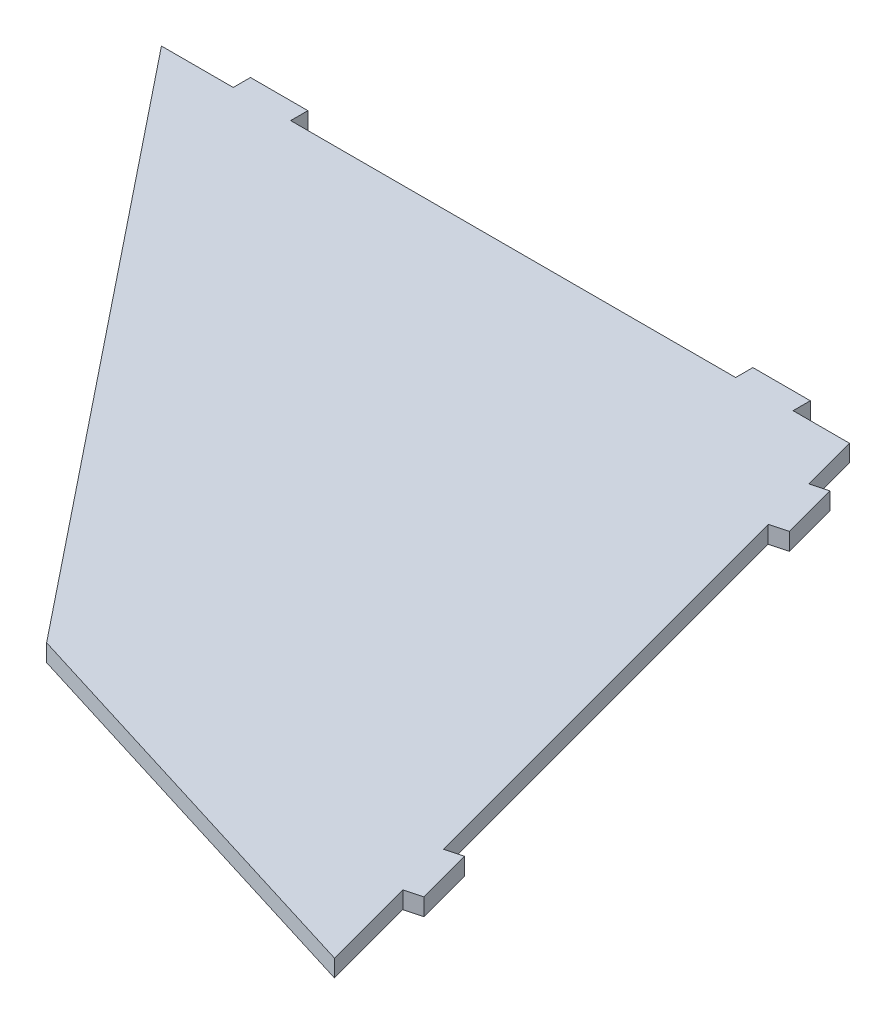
SolidWorks part; units mm, degrees
ref_plane "Ebene vorne" through (0, 0, 0) normal (0, 0, 1) x (1, 0, 0)
ref_plane "Ebene oben" through (0, 0, 0) normal (0, 1, 0) x (1, 0, 0)
ref_plane "Ebene rechts" through (0, 0, 0) normal (1, 0, 0) x (0, 0, -1)
sketch "Skizze1" plane through (0, 0, 0) normal (0, 1, 0) x (1, 0, 0)
  line L0 (0, 86.8409) -> (0, -76.1078) construction
  line L1 (-105.0548, 0) -> (-135, 0) construction
  line L2 (0, -200) -> (0, 86.8409) construction
  line L3 (-224, 0) -> (-135, 0) construction
  line L4 (90.5872, -17.7656) -> (95.7636, -37.0841)
  line L5 (60, 0) -> (60, 6)
  line L6 (160, 0) -> (160, -246.2068) construction
  line L7 (60, 6) -> (40, 6)
  line L8 (40, 0) -> (40, 6)
  line L9 (-115, 0) -> (40, 0) construction
  line L10 (60, 0) -> (160, 0) construction
  line L11 (-135, 0) -> (-135, 6)
  line L12 (-135, 6) -> (-115, 6)
  line L13 (-115, 0) -> (-115, 6)
  line L14 (-115, 0) -> (40, 0) construction
  line L15 (-115, 0) -> (40, 0)
  line L16 (60, 0) -> (79.6152, 0)
  line L17 (90.5872, -17.7656) -> (84.7916, -19.3185)
  line L18 (95.7636, -37.0841) -> (89.968, -38.637)
  line L19 (-160, 0) -> (0, -200)
  line L20 (84.7916, -19.3185) -> (79.6152, 0)
  line L21 (137.1746, -191.6323) -> (142.351, -210.9508)
  line L22 (137.1746, -191.6323) -> (131.3791, -193.1852)
  line L23 (0, -200) -> (145.2628, -245)
  line L24 (142.351, -210.9508) -> (136.5554, -212.5037)
  line L25 (131.3791, -193.1852) -> (89.968, -38.637)
  line L26 (145.2628, -245) -> (136.5554, -212.5037)
  line L27 (-160, 0) -> (-135, 0)
  dimension "D1" = 384
  dimension "D2" = 239.6152
  dimension "D3" = 160
  dimension "D4" = 200
  dimension "D5" = 45
  dimension "D6" = 6
  dimension "D7" = 20
  dimension "D8" = 40
  dimension "D9" = 20
  dimension "D10" = 115
  dimension "D11" = 20
  dimension "D12" = 20
  dimension "D13" = 6
  dimension "D14" = 20
  dimension "D15" = 160
  dimension "D16" = 160
  dimension "D19" = 15
extrude "Aufsatz-Linear austragen1" add sketch "Skizze1" along normal blind 6
